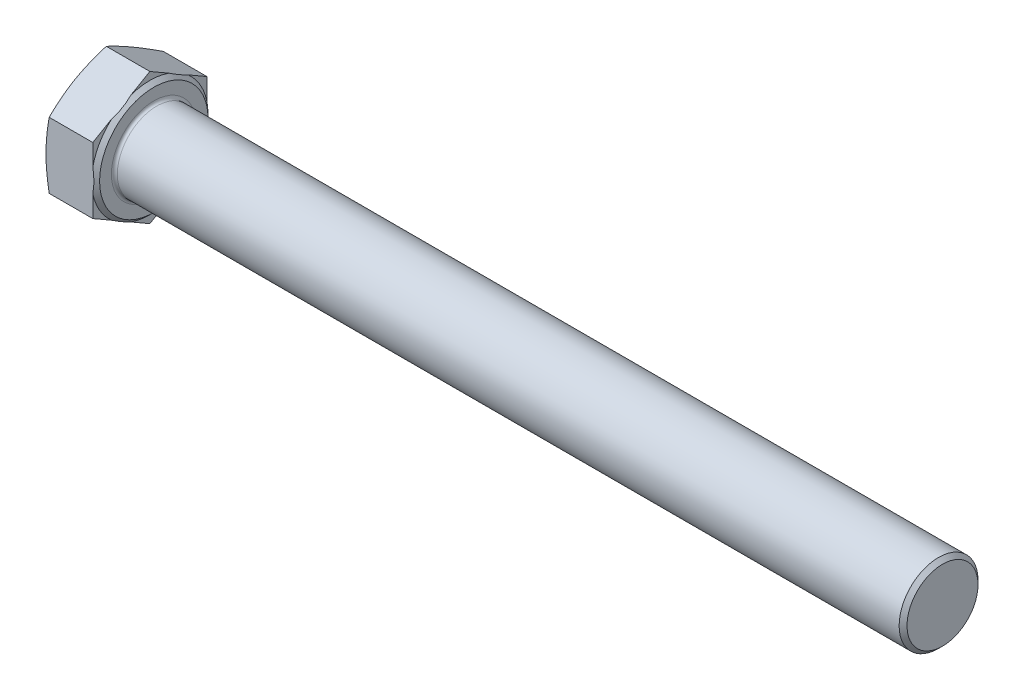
SolidWorks part; units mm, degrees
ref_plane "Front" through (0, 0, 0) normal (0, 0, 1) x (1, 0, 0)
ref_plane "Top" through (0, 0, 0) normal (0, 1, 0) x (1, 0, 0)
ref_plane "Right" through (0, 0, 0) normal (1, 0, 0) x (0, 0, -1)
sketch "Sketch2" plane through (0, 0, 0) normal (1, 0, 0) x (0, 0, -1)
  line L1 (11.58, -6.6857) -> (11.58, 6.6857)
  line L2 (11.58, 6.6857) -> (0, 13.3714)
  line L3 (0, 13.3714) -> (-11.58, 6.6857)
  line L4 (-11.58, 6.6857) -> (-11.58, -6.6857)
  line L5 (-11.58, -6.6857) -> (0, -13.3714)
  line L6 (0, -13.3714) -> (11.58, -6.6857)
  circle A0 centre (0, 0) radius 11.58 construction
  dimension "s" = 23.16
extrude "BaseHead" add sketch "Sketch2" along normal blind 10.29
sketch "Sketch3" plane through (0, 0, 0) normal (0, 0, 1) x (1, 0, 0)
  line L0 (10.29, 13.3714) -> (10.29, 11)
  line L2 (10.29, 11) -> (9.49, 11.8)
  line L3 (9.49, 11.8) -> (9.49, 13.3714)
  line L5 (9.49, 13.3714) -> (10.29, 13.3714)
  line L6 (-0.9571, 0) -> (7.6478, 0) construction
  line L7 (10.29, 13.3714) -> (0, 13.3714) construction
  dimension "D1" = 45
  dimension "c" = 0.8
  dimension "dw" = 22
revolve "BearingFace" cut sketch "Sketch3" angle 360 about L6
sketch "Sketch4" plane through (0, 0, 0) normal (0, 0, 1) x (1, 0, 0)
  line L0 (-0.4935, 0) -> (3.5626, 0) construction
  line L2 (0, 13.3714) -> (0.652, 13.3714)
  line L4 (0.652, 13.3714) -> (0, 11.58)
  line L6 (0, 11.58) -> (0, 13.3714)
  line L7 (9.49, 13.3714) -> (0, 13.3714) construction
  dimension "D1" = 20
  dimension "D2" = 23.16
revolve "HeadChamfer" cut sketch "Sketch4" angle 360 about L0
sketch "Sketch5" plane through (10.29, 0, 0) normal (1, 0, 0) x (0, 0, -1)
  circle A0 centre (0, 0) radius 8
  dimension "d" = 16
extrude "BaseBody" add sketch "Sketch5" along normal blind 160
chamfer "Chamfer1" distance 0.8 angle 45 1 edges at (170.29, 0, -8)
fillet "HeadFillet" radius 0.6 1 edges at (10.29, 0, 8)
equation "\"D2@Sketch4\" = \"s@Sketch2\""
equation "\"D1@Chamfer1\" = 0.05 * \"d@Sketch5\""
